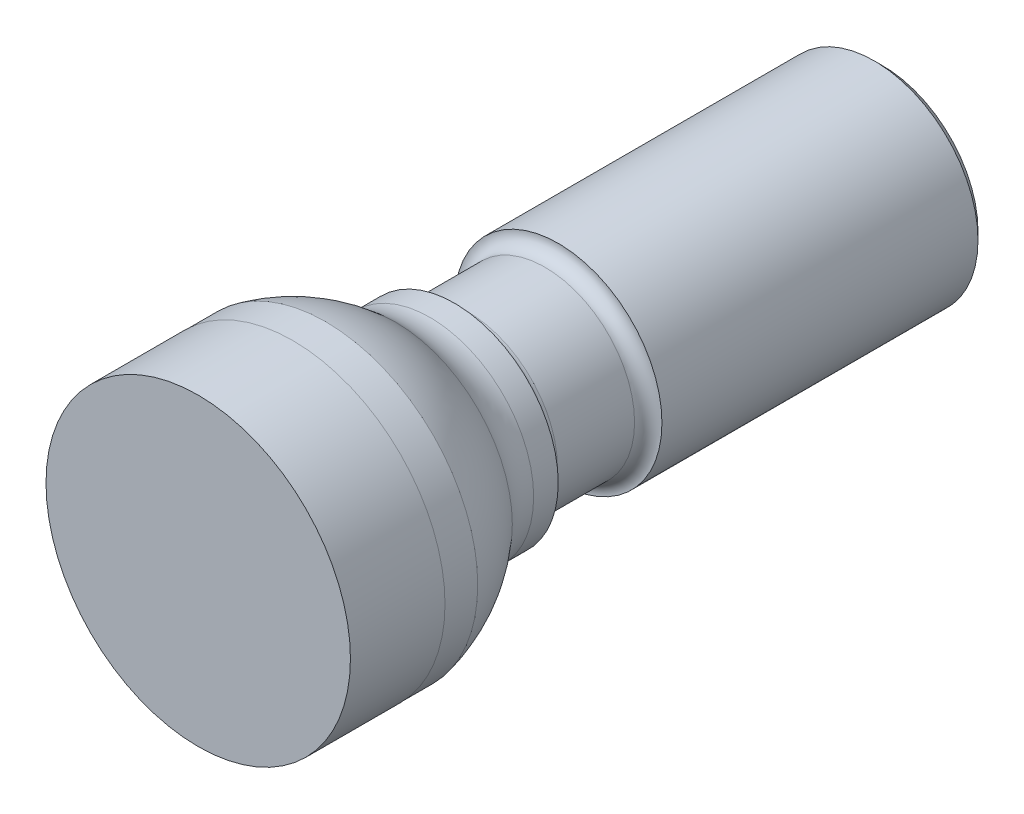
SolidWorks part; units mm, degrees
ref_plane "Front Plane" through (0, 0, 0) normal (0, 0, 1) x (1, 0, 0)
ref_plane "Top Plane" through (0, 0, 0) normal (0, 1, 0) x (1, 0, 0)
ref_plane "Right Plane" through (0, 0, 0) normal (1, 0, 0) x (0, 0, -1)
sketch "Sketch1" plane through (0, 0, 0) normal (1, 0, 0) x (0, 0, -1)
  line L0 (0, 0) -> (44.2441, 0) construction
  line L1 (0, 0) -> (30.6043, 0)
  line L46 (7.8077, 9.3091) -> (5.7912, 9.3091)
  line L47 (5.7912, 9.3091) -> (5.7912, 9.3218)
  line L48 (5.7912, 9.3218) -> (0, 9.3218)
  line L49 (0, 9.3218) -> (0, 0)
  line L61 (30.6043, 0) -> (32.512, 3.175)
  line L63 (32.512, 3.175) -> (41.91, 3.175)
  line L64 (41.91, 3.175) -> (41.91, 5.842)
  line L65 (41.91, 5.842) -> (41.402, 6.35)
  line L66 (41.402, 6.35) -> (22.0472, 6.35)
  line L67 (21.236, 5.4864) -> (16.5084, 5.4864)
  line L68 (15.6972, 6.35) -> (14.1915, 6.35)
  arc A20 (21.236, 5.4864) -> (22.0472, 6.35) centre (21.236, 6.2992) ccw
  arc A21 (15.6972, 6.35) -> (16.5084, 5.4864) centre (16.5084, 6.2992) ccw
  arc A22 (12.0914, 7.1437) -> (14.1915, 6.35) centre (14.1915, 9.525) ccw
  arc A23 (12.0914, 7.1437) -> (7.8077, 9.3091) centre (5.7912, 0) ccw
  dimension "D14" = 0.8128
  dimension "D16" = 3.175
  dimension "D17" = 8.4003
  dimension "D18" = 9.525
  dimension "D1" = 18.6436
  dimension "D2" = 5.7912
  dimension "D3" = 18.6182
  dimension "D4" = 36.1188
  dimension "D5" = 16.256
  dimension "D6" = 12.7
  dimension "D7" = 45
  dimension "D8" = 0.508
  dimension "D9" = 9.398
  dimension "D10" = 59
  dimension "D11" = 6.35
  dimension "D12" = 12.7
  dimension "D13" = 10.9728
  dimension "D15" = 9.906
revolve "Revolve2" add sketch "Sketch1" angle 360 about L0
sketch "Sketch2" plane through (0, 0, -41.91) normal (0, 0, -1) x (-1, 0, 0)
  line L1 (3.6662, 0) -> (1.8331, 3.175)
  line L2 (1.8331, 3.175) -> (-1.8331, 3.175)
  line L3 (-1.8331, 3.175) -> (-3.6662, 0)
  line L4 (-3.6662, 0) -> (-1.8331, -3.175)
  line L5 (-1.8331, -3.175) -> (1.8331, -3.175)
  line L6 (1.8331, -3.175) -> (3.6662, 0)
  circle A0 centre (0, 0) radius 3.175 construction
  dimension "D1" = 6.35
extrude "Cut-Extrude1" cut sketch "Sketch2" against normal blind 6.35
